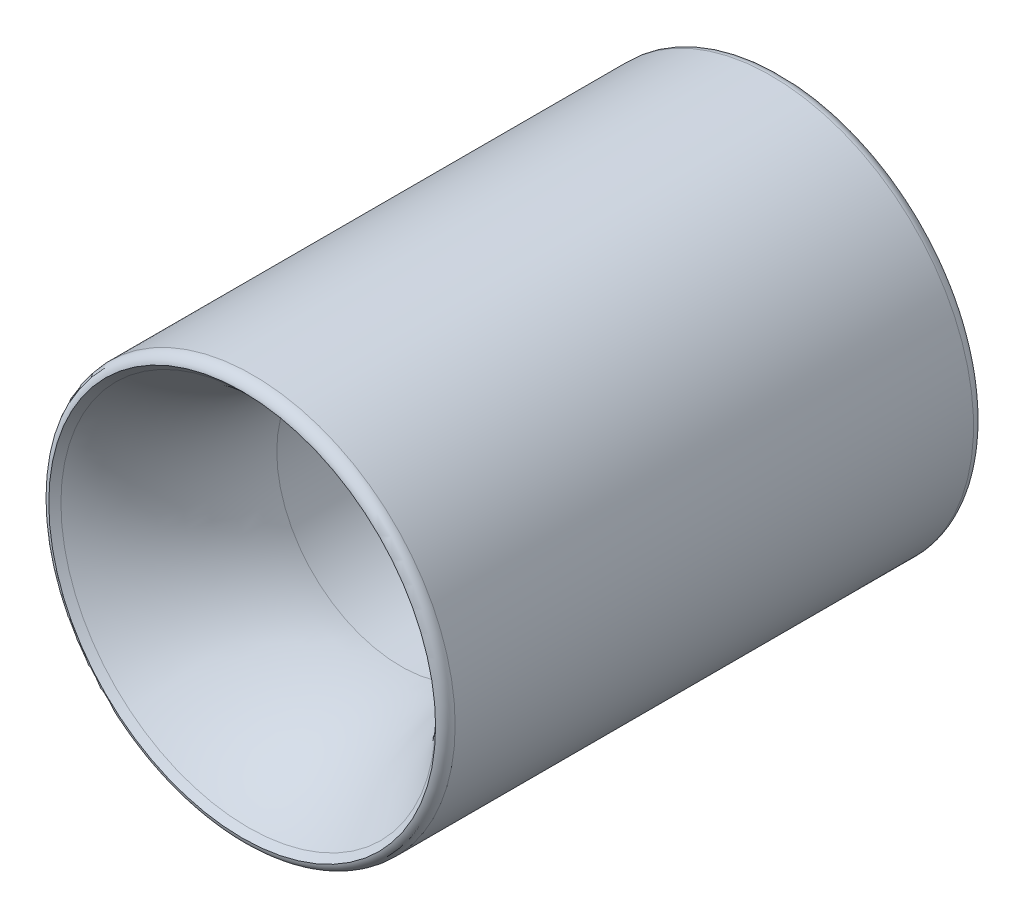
SolidWorks part; units mm, degrees
ref_plane "Front" through (0, 0, 0) normal (0, 0, 1) x (1, 0, 0)
ref_plane "Top" through (0, 0, 0) normal (0, 1, 0) x (1, 0, 0)
ref_plane "Right" through (0, 0, 0) normal (1, 0, 0) x (0, 0, -1)
sketch "Sketch1" plane through (0, 0, 0) normal (0, 0, 1) x (1, 0, 0)
  circle A0 centre (0, 0) radius 1.4605
  circle A1 centre (0, 0) radius 2.3813
extrude "Extrude1" add sketch "Sketch1" along normal blind 6.35
chamfer "Chamfer1" distance 0.8153 angle 45 2 edges at (1.4605, 0, 6.35) (1.4605, 0, 0)
fillet "Fillet1" radius 0.127 1 edges at (2.3813, 0, 6.35)
fillet "Fillet3" radius 0.127 1 edges at (2.3813, 0, 0)
fillet "Fillet4" radius 2.54 2 edges at (1.4605, 0, 0.8153) (1.4605, 0, 5.5347)
